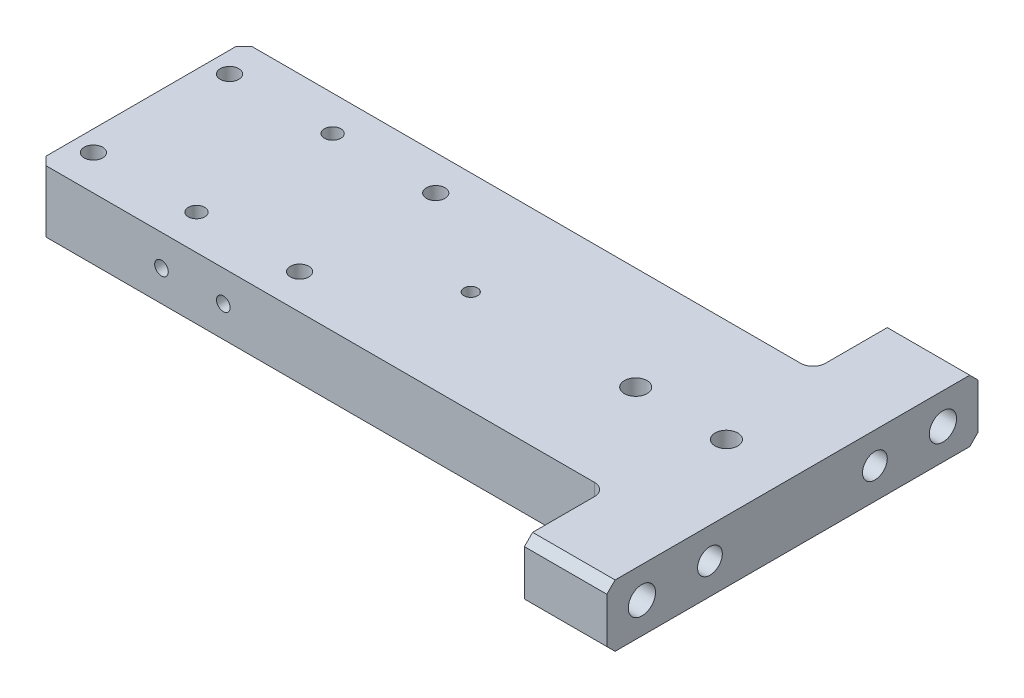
SolidWorks part; units mm, degrees
ref_plane "前视基准面" through (0, 0, 0) normal (0, 0, 1) x (1, 0, 0)
ref_plane "上视基准面" through (0, 0, 0) normal (0, 1, 0) x (1, 0, 0)
ref_plane "右视基准面" through (0, 0, 0) normal (1, 0, 0) x (0, 0, -1)
sketch "草图1" plane through (0, 0, 0) normal (0, 1, 0) x (1, 0, 0)
  line L1 (-79, 45) -> (79, 45)
  line L2 (-79, 45) -> (-79, -45)
  line L3 (-79, -45) -> (79, -45)
  line L4 (79, 45) -> (79, -45)
  line L5 (-79, 45) -> (79, -45) construction
  line L6 (-79, -45) -> (79, 45) construction
  point P0 (0, 0)
  dimension "D1" = 158
  dimension "D2" = 90
extrude "凸台-拉伸1" add sketch "草图1" along normal blind 15
hole_wizard "M4 六角圆柱头螺钉的柱形沉头孔1" positions "草图13" profile "草图14" counterbore size "M4" standard "GB"
sketch "草图13" plane through (0, 0, 0) normal (0, -1, 0) x (-1, 0, 0)
  line L1 (24, 16.5) -> (74, 16.5) construction
  line L2 (24, 16.5) -> (24, -16.5) construction
  line L3 (24, -16.5) -> (74, -16.5) construction
  line L4 (74, 16.5) -> (74, -16.5) construction
  line L5 (74, 0) -> (79, 0) construction
  line L6 (79, 45) -> (79, -45) construction
  point P0 (74, 16.5)
  point P3 (74, -16.5)
  point P6 (24, 16.5)
  point P9 (24, -16.5)
  dimension "D1" = 50
  dimension "D2" = 33
  dimension "D3" = 5
sketch "草图14" plane through (-74, 0, -16.5) normal (1, 0, 0) x (0, 0, -1)
  line L0 (0, 0) -> (0, 15)
  line L1 (0, 15) -> (2.25, 15)
  line L3 (2.25, 15) -> (2.25, 4.6)
  line L4 (2.25, 4.6) -> (4, 4.6)
  line L5 (4, 4.6) -> (4, 0)
  line L7 (4, 0) -> (0, 0)
  line L11 (0, -6.35) -> (0, 107.95) construction
  dimension "通孔孔直径" = 4.5
  dimension "通孔孔深度" = 15
  dimension "柱形沉头孔直径" = 8
  dimension "柱形沉头孔深度" = 4.6
hole_wizard "Ø4.0mm 暗销孔1" positions "草图17" profile "草图18" hole size "Ø4.0" standard "ISO"
sketch "草图17" plane through (0, 15, 0) normal (0, 1, 0) x (1, 0, 0)
  line L5 (-74, -16.5) -> (-24, -16.5) construction
  line L7 (-74, 16.5) -> (-24, 16.5) construction
  point P0 (-49, -16.5)
  point P3 (-49, 16.5)
sketch "草图18" plane through (-49, 15, 16.5) normal (1, 0, 0) x (0, 0, 1)
  line L0 (0, 0) -> (0, 5)
  line L1 (0, 5) -> (2, 5)
  line L2 (2, 5) -> (2, 0)
  line L5 (2, 0) -> (0, 0)
  line L10 (0, 5) -> (-2, 5) construction
  line L11 (0, -6.35) -> (0, 107.95) construction
  dimension "孔直径" = 4
  dimension "孔深度" = 5
  dimension "导头角度" = 180
hole_wizard "M4 螺纹孔3" positions "草图39" profile "草图40" tap size "M4" standard "GB"
sketch "草图39" plane through (0, 15, 0) normal (0, 1, 0) x (1, 0, 0)
  line L0 (0, 0) -> (-50000, 0) construction
  line L3 (-79, 45) -> (-79, -45) construction
  point P10 (1, 0)
  dimension "D1" = 80
sketch "草图40" plane through (1, 15, 0) normal (1, 0, 0) x (0, 0, 1)
  line L0 (0, 0) -> (0, 15)
  line L1 (0, 15) -> (1.65, 15)
  line L2 (1.65, 15) -> (1.65, 0)
  line L5 (1.65, 0) -> (0, 0)
  line L11 (0, -6.35) -> (0, 107.95) construction
  dimension "通孔螺纹孔钻头直径" = 3.3
  dimension "通孔螺纹孔钻头深度" = 15
sketch "草图49" plane through (0, 15, 0) normal (0, 1, 0) x (1, 0, 0)
  line L0 (-79, 0) -> (66.5972, 0) construction
  line L1 (-144.979, -65.6184) -> (59, -65.6184)
  line L2 (-144.979, -65.6184) -> (-144.979, -25)
  line L3 (-144.979, -25) -> (59, -25)
  line L4 (59, -65.6184) -> (59, -25)
  line L5 (-144.979, 88.7615) -> (59, 88.7615)
  line L6 (-144.979, 88.7615) -> (-144.979, 25)
  line L7 (-144.979, 25) -> (59, 25)
  line L8 (59, 88.7615) -> (59, 25)
  line L9 (-79, 45) -> (-79, -45) construction
  line L10 (79, -45) -> (79, 45) construction
  dimension "D1" = 50
  dimension "D2" = 20
extrude "切除-拉伸3" cut sketch "草图49" against normal through all
hole_wizard "M6 间隙孔2" positions "草图52" profile "草图53" hole size "M6" standard "ISO"
sketch "草图52" plane through (59, 0, 0) normal (-1, 0, 0) x (0, 0, 1)
  line L1 (45, 7.5) -> (-45, 7.5) construction
  line L2 (45, 15) -> (45, 0) construction
  line L3 (-45, 0) -> (-45, 15) construction
  line L5 (0, 0) -> (0, 7.5) construction
  point P0 (36.5, 7.5)
  point P2 (-36.5, 7.5)
  dimension "D1" = 8.5
sketch "草图53" plane through (59, 7.5, 36.5) normal (0, 1, 0) x (0, 0, 1)
  line L0 (0, 0) -> (0, 20)
  line L1 (0, 20) -> (3.3, 20)
  line L2 (3.3, 20) -> (3.3, 0)
  line L5 (3.3, 0) -> (0, 0)
  line L11 (0, -6.35) -> (0, 107.95) construction
  dimension "通孔孔直径" = 6.6
  dimension "通孔孔深度" = 20
hole_wizard "Ø6.0mm 暗销孔1" positions "草图57" profile "草图58" hole size "Ø6.0" standard "GB"
sketch "草图57" plane through (79, 0, 0) normal (1, 0, 0) x (0, 0, -1)
  line L1 (0, 15) -> (0, 0) construction
  line L2 (-45, 15) -> (45, 15) construction
  line L3 (-45, 0) -> (45, 0) construction
  line L7 (-20, 7.5) -> (-45, 7.5) construction
  line L8 (-45, 15) -> (-45, 0) construction
  point P0 (-20, 7.5)
  point P2 (20, 7.5)
  dimension "D1" = 40
sketch "草图58" plane through (79, 7.5, 20) normal (0, 1, 0) x (0, 0, -1)
  line L0 (0, 0) -> (0, 5)
  line L1 (0, 5) -> (3, 5)
  line L2 (3, 5) -> (3, 0)
  line L5 (3, 0) -> (0, 0)
  line L10 (0, 5) -> (-3, 5) construction
  line L11 (0, -6.35) -> (0, 107.95) construction
  dimension "孔直径" = 6
  dimension "孔深度" = 5
  dimension "导头角度" = 180
hole_wizard "M4 螺纹孔4" positions "草图60" profile "草图59" tap size "M4" standard "GB"
sketch "草图60" plane through (0, 0, 0) normal (0, -1, 0) x (-1, 0, 0)
  point P1 (30, 6)
  point P2 (45, 6)
  dimension "D1" = 30
  dimension "D2" = 45
  dimension "D3" = 6
sketch "草图59" plane through (-30, 0, -6) normal (1, 0, 0) x (0, 0, -1)
  line L0 (0, 0) -> (0, 8.9914)
  line L1 (0, 8.9914) -> (1.65, 8)
  line L2 (1.65, 8) -> (1.65, 0)
  line L5 (1.65, 0) -> (0, 0)
  line L10 (0, 8.9914) -> (-1.65, 8) construction
  line L11 (0, -6.35) -> (0, 107.95) construction
  dimension "螺纹孔钻头直径" = 3.3
  dimension "螺纹孔钻头深度" = 8
  dimension "导头角度" = 118
hole_wizard "M4 螺纹孔5" positions "草图61" profile "草图62" tap size "M4" standard "GB"
sketch "草图61" plane through (0, 0, -25) normal (0, 0, -1) x (-1, 0, 0)
  line L0 (79, 15) -> (-59, 15) construction
  line L1 (79, 15) -> (79, 0) construction
  point P0 (4, 7.5)
  dimension "D1" = 7.5
  dimension "D2" = 75
sketch "草图62" plane through (-4, 7.5, -25) normal (1, 0, 0) x (0, 1, 0)
  line L0 (0, 0) -> (0, 11.0914)
  line L1 (0, 11.0914) -> (1.65, 10.1)
  line L2 (1.65, 10.1) -> (1.65, 0)
  line L5 (1.65, 0) -> (0, 0)
  line L10 (0, 11.0914) -> (-1.65, 10.1) construction
  line L11 (0, -6.35) -> (0, 107.95) construction
  dimension "螺纹孔钻头直径" = 3.3
  dimension "螺纹孔钻头深度" = 10.1
  dimension "导头角度" = 118
fillet "圆角2" radius 3 2 edges at (59, 7.5, -25) (59, 7.5, 25)
chamfer "倒角4" distance 2 angle 45 6 edges at (-79, 7.5, 25) (-79, 7.5, -25) (69, 0, -45) (69, 0, 45) (69, 15, 45) (69, 15, -45)
hole_wizard "M5 六角凹头螺钉的柱形沉头孔1" positions "草图67" profile "草图68" counterbore size "M5" standard "ISO"
sketch "草图67" plane through (0, 0, 0) normal (0, -1, 0) x (-1, 0, 0)
  line L0 (-79, -43) -> (-79, 43) construction
  point P0 (-63, 0)
  point P3 (-41, 0)
  dimension "D1" = 16
  dimension "D2" = 22
sketch "草图68" plane through (63, 0, 0) normal (1, 0, 0) x (0, 0, -1)
  line L0 (0, 0) -> (0, 15)
  line L1 (0, 15) -> (2.75, 15)
  line L3 (2.75, 15) -> (2.75, 5.4)
  line L4 (2.75, 5.4) -> (5, 5.4)
  line L5 (5, 5.4) -> (5, 0)
  line L7 (5, 0) -> (0, 0)
  line L11 (0, -6.35) -> (0, 107.95) construction
  dimension "通孔孔直径" = 5.5
  dimension "通孔孔深度" = 15
  dimension "柱形沉头孔直径" = 10
  dimension "柱形沉头孔深度" = 5.4
hole_wizard "M4 螺纹孔6" positions "草图69" profile "草图70" tap size "M4" standard "GB"
sketch "草图69" plane through (0, 0, 25) normal (0, 0, 1) x (1, 0, 0)
  line L0 (-77, 7.5) -> (-20.0432, 7.5) construction
  line L1 (-77, 15) -> (-77, 0) construction
  line L3 (-79, 0) -> (-79, 15) construction
  point P0 (-49, 7.5)
  point P2 (-34, 7.5)
  point P11 (-63.0628, 7.5)
  dimension "D1" = 15
  dimension "D2" = 30
sketch "草图70" plane through (-49, 7.5, 25) normal (1, 0, 0) x (0, -1, 0)
  line L0 (0, 0) -> (0, 11.0914)
  line L1 (0, 11.0914) -> (1.65, 10.1)
  line L2 (1.65, 10.1) -> (1.65, 0)
  line L5 (1.65, 0) -> (0, 0)
  line L10 (0, 11.0914) -> (-1.65, 10.1) construction
  line L11 (0, -6.35) -> (0, 107.95) construction
  dimension "螺纹孔钻头直径" = 3.3
  dimension "螺纹孔钻头深度" = 10.1
  dimension "导头角度" = 118
mirror "镜向1" about plane through (0, 0, 0) normal (0, 0, 1) of "M4 螺纹孔6"
